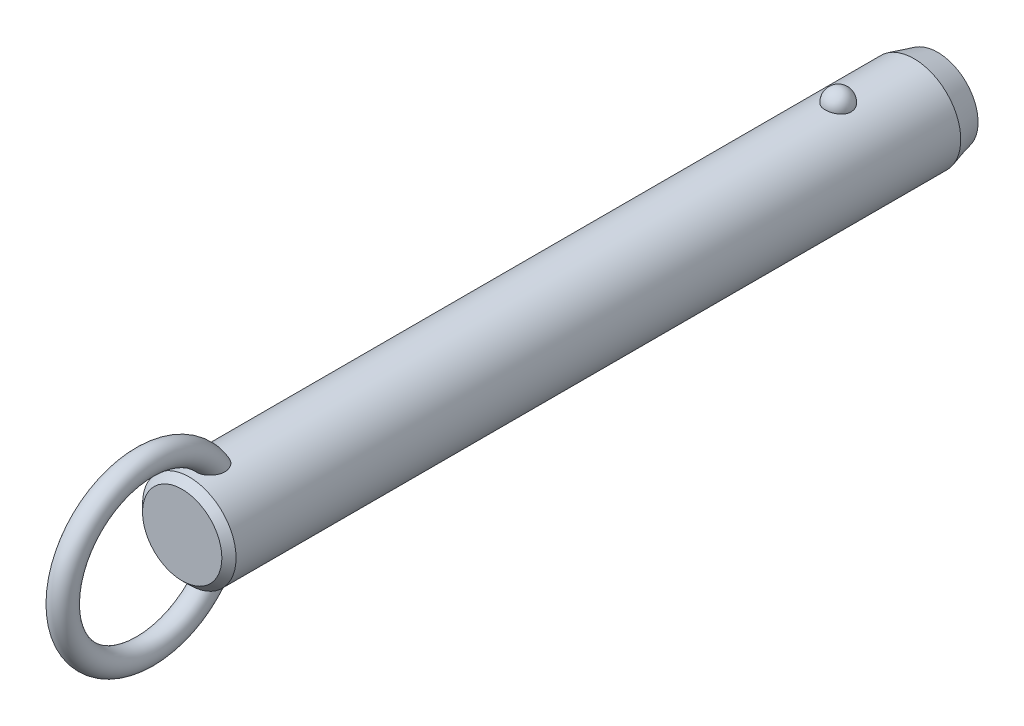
SolidWorks part; units mm, degrees
ref_plane "Front Plane" through (0, 0, 0) normal (0, 0, 1) x (1, 0, 0)
ref_plane "Top Plane" through (0, 0, 0) normal (0, 1, 0) x (1, 0, 0)
ref_plane "Right Plane" through (0, 0, 0) normal (1, 0, 0) x (0, 0, -1)
sketch "Sketch2" plane through (0, 0, 0) normal (0, 0, 1) x (1, 0, 0)
  circle A0 centre (0, 0) radius 7.9
  point P3 (0, 7.9)
  dimension "D1" = 15.8
extrude "Boss-Extrude1" add sketch "Sketch2" along normal blind 99.1
sketch "Sketch3" plane through (0, 0, 0) normal (0, 0, -1) x (-1, 0, 0)
  circle A0 centre (0, 0) radius 7.9
  dimension "D1" = 15.8
extrude "Boss-Extrude2" add sketch "Sketch3" along normal blind 19
chamfer "Chamfer1" distance 4 angle 15 1 edges at (-7.9, 0, -19)
sketch "Sketch12" plane through (0, 0, 0) normal (1, 0, 0) x (0, 0, -1)
  line L0 (-99.1, 7.9) -> (-99.1, -7.9) construction
  point P0 (-99.1, 0)
sketch "Sketch13" plane through (0, 0, 0) normal (1, 0, 0) x (0, 0, -1)
  circle A0 centre (-114.95, 0) radius 15.85
  point P2 (-99.1, 0)
  dimension "D1" = 31.7
sketch "Sketch14" plane through (0, 0, 0) normal (0, 1, 0) x (1, 0, 0)
  circle A0 centre (0, -101.1) radius 2
  point P2 (0, -99.1)
  dimension "D1" = 4
sweep "Sweep1" add profiles "Sketch14" path "Sketch13"
sketch "Sketch15" plane through (0, 0, 99.1) normal (0, 0, 1) x (1, 0, 0)
  circle A0 centre (0, 0) radius 7.9
  dimension "D1" = 15.8
extrude "Boss-Extrude3" add sketch "Sketch15" along normal blind 9.52
chamfer "Chamfer2" distance 1.2 angle 45 1 edges at (7.9, 0, 108.62)
sketch "Sketch18" plane through (0, 0, 0) normal (1, 0, 0) x (0, 0, -1)
  line L0 (15, 7.9) -> (-101.2091, 7.9) construction
  line L1 (2.2, 10.1) -> (2.2, 5.7)
  line L2 (-101.2091, -7.9) -> (15, -7.9) construction
  arc A0 (2.2, 10.1) -> (2.2, 5.7) centre (2.2, 7.9) ccw
  point P4 (0, 7.9)
  dimension "D1" = 18
revolve "Revolve1" add sketch "Sketch18" angle 360 about L1
